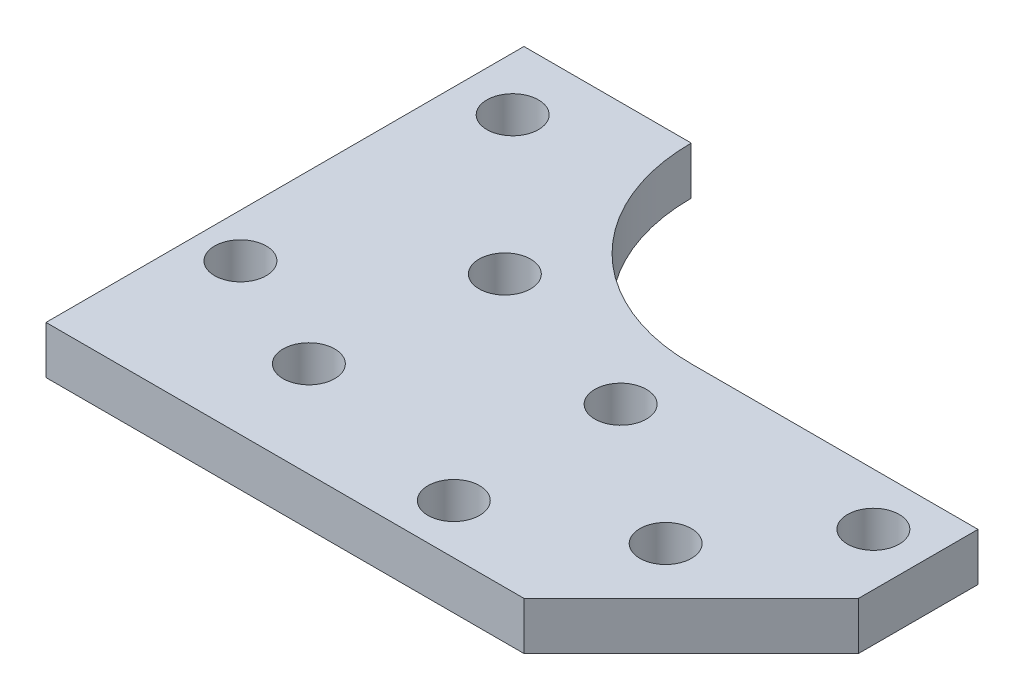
SolidWorks part; units mm, degrees
ref_plane "Front Plane" through (0, 0, 0) normal (0, 0, 1) x (1, 0, 0)
ref_plane "Top Plane" through (0, 0, 0) normal (0, 1, 0) x (1, 0, 0)
ref_plane "Right Plane" through (0, 0, 0) normal (1, 0, 0) x (0, 0, -1)
sketch "Sketch1" plane through (0, 0, 0) normal (0, 1, 0) x (1, 0, 0)
  line L0 (0, 0) -> (100, 0)
  line L1 (100, 0) -> (135, 35)
  line L2 (135, 35) -> (135, 60)
  line L3 (135, 60) -> (75, 60)
  line L4 (35, 100) -> (0, 100)
  line L5 (0, 100) -> (0, 0)
  arc A0 (75, 60) -> (35, 100) centre (75, 100) cw
  dimension "D3" = 40
  dimension "D1" = 100
  dimension "D2" = 100
  dimension "D4" = 135
  dimension "D5" = 25
  dimension "D6" = 35
extrude "Extrude1" add sketch "Sketch1" along normal blind 10
hole_wizard "M12x1.25 Tapped Hole1" positions "Sketch5" profile "Sketch6" tap size "M12x1.25" standard "Ansi Metric"
sketch "Sketch5" plane through (0, 10, 0) normal (0, 1, 0) x (-1, 0, 0)
  line L0 (0, 0) -> (-100, 0) construction
  line L1 (0, -100) -> (0, 0) construction
  point P0 (-35, -20)
  dimension "D1" = 20
  dimension "D2" = 35
sketch "Sketch6" plane through (35, 10, -20) normal (1, 0, 0) x (0, 0, 1)
  line L0 (0, 0) -> (0, 10)
  line L1 (0, 10) -> (5.4, 10)
  line L2 (5.4, 10) -> (5.4, 0)
  line L5 (5.4, 0) -> (0, 0)
  line L11 (0, -6.35) -> (0, 107.95) construction
  dimension "Thru Tap Drill Dia." = 10.8
  dimension "Thru Tap Drill Depth" = 10
sketch "Sketch2" plane through (0, 10, 0) normal (0, 1, 0) x (-1, 0, 0)
  point P0 (-9.1822, -31.4953)
  point P1 (-74.9366, -10.3861)
  point P2 (-39.229, -56.7757)
  point P3 (-104.8832, -24.7664)
  point P4 (-124.0421, -49.0654)
  point P7 (-11.1916, -86.4486)
  point P8 (-74.9366, -45.2922)
pattern_sketch "Sketch-Pattern2" of "M12x1.25 Tapped Hole1"
